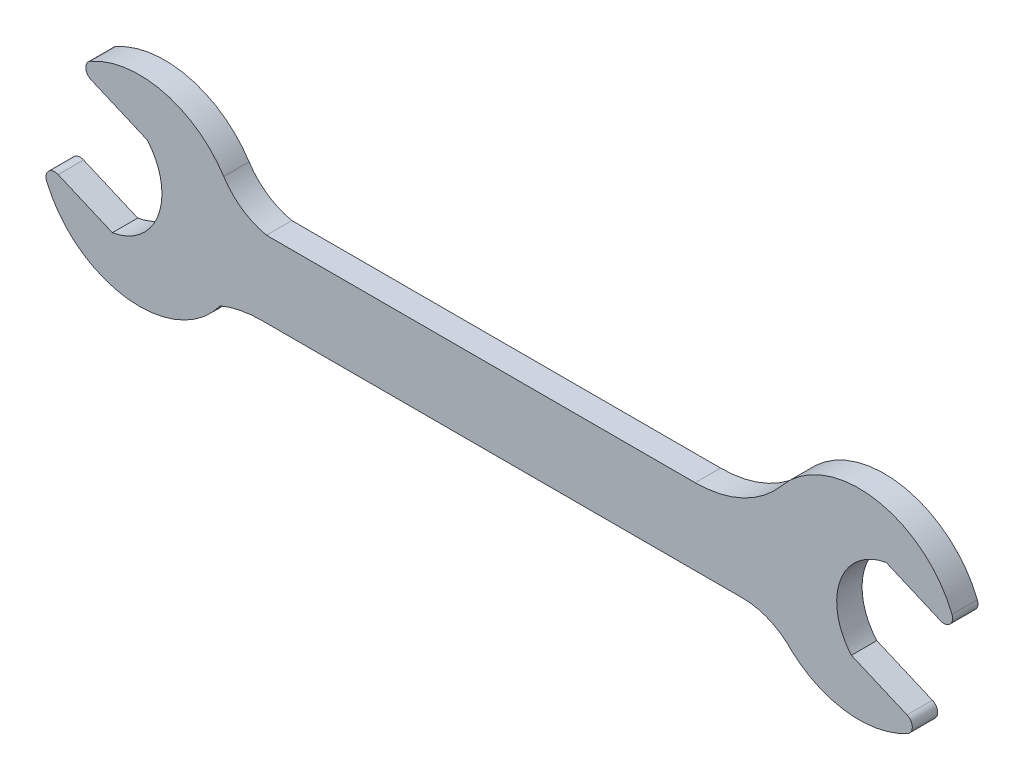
SolidWorks part; units mm, degrees
ref_plane "Plane1" through (0, 0, 0) normal (0, 0, 1) x (1, 0, 0)
ref_plane "Plane2" through (0, 0, 0) normal (0, 1, 0) x (1, 0, 0)
ref_plane "Plane3" through (0, 0, 0) normal (1, 0, 0) x (0, 0, -1)
sketch "Sketch1" plane through (88.7363, -76.0772, 0) normal (0, 0, 1) x (1, 0, 0)
  line L0 (-1.544, 356.8992) -> (39.1367, 339.4646)
  line L1 (-27.7035, 283.5501) -> (14.0318, 265.6635)
  line L5 (-470.0724, 279.9262) -> (-109.3915, 279.9262)
  line L9 (-556.1526, 354.2155) -> (-598.307, 372.2817)
  line L12 (-666.7701, 121.1337) -> (-667.3543, 121.7179) construction
  line L13 (-582.3121, 280.8664) -> (-622.9928, 298.301)
  line L16 (-144.9401, 337.0762) -> (-466.7004, 337.0762)
  arc A0 (-1.544, 356.8992) -> (-27.7035, 283.5501) centre (5.8402, 312.9263) ccw
  arc A1 (14.6382, 253.9295) -> (14.0318, 265.6635) centre (11.4536, 259.6476) ccw
  arc A2 (-109.3915, 279.9262) -> (-71.8166, 263.2767) centre (-109.3915, 229.2016) cw
  arc A3 (-144.9401, 337.0762) -> (-79.9946, 367.6489) centre (-144.9401, 421.3445) ccw
  arc A4 (47.7816, 347.937) -> (-79.9946, 367.6489) centre (-21.9849, 319.6877) ccw
  arc A5 (47.7816, 347.937) -> (39.1367, 339.4646) centre (41.7149, 345.4805) cw
  arc A6 (-71.8166, 263.2767) -> (14.6382, 253.9295) centre (-21.9849, 319.6877) ccw
  arc A7 (-498.7467, 359.1961) -> (-598.6285, 384.1653) centre (-562.0054, 318.4072) ccw
  arc A12 (-582.3121, 280.8664) -> (-556.1526, 354.2155) centre (-589.6963, 324.8393) ccw
  arc A13 (-598.6285, 384.1653) -> (-598.307, 372.2817) centre (-595.7288, 378.2976) ccw
  arc A14 (-466.7004, 337.0762) -> (-498.7467, 359.1961) centre (-456.1159, 386.6842) cw
  arc A15 (-470.0724, 279.9262) -> (-501.2799, 273.9346) centre (-470.0724, 195.6579) ccw
  arc A16 (-631.6377, 289.8286) -> (-501.2799, 273.9346) centre (-562.0054, 318.4072) ccw
  arc A17 (-631.6377, 289.8286) -> (-622.9928, 298.301) centre (-625.571, 292.2851) cw
  dimension "D1" = 57.15
extrude "Base-Extrude" add sketch "Sketch1" along normal mid plane 19.05
sketch "Sketch2" plane through (0, 0, 9.525) normal (0, 0, 1) x (1, 0, 0)
  line L0 (-56.2038, 260.999) -> (-377.964, 260.999) construction
  line L1 (-369.0587, 248.299) -> (-38.8587, 248.299)
  line L3 (-369.0587, 216.549) -> (-38.8587, 216.549)
  arc A0 (-369.0587, 248.299) -> (-369.0587, 216.549) centre (-369.0587, 232.424) ccw
  arc A1 (-38.8587, 248.299) -> (-38.8587, 216.549) centre (-38.8587, 232.424) cw
  dimension "D1" = 31.75
  dimension "D2" = 330.2
  dimension "D3" = 12.7
